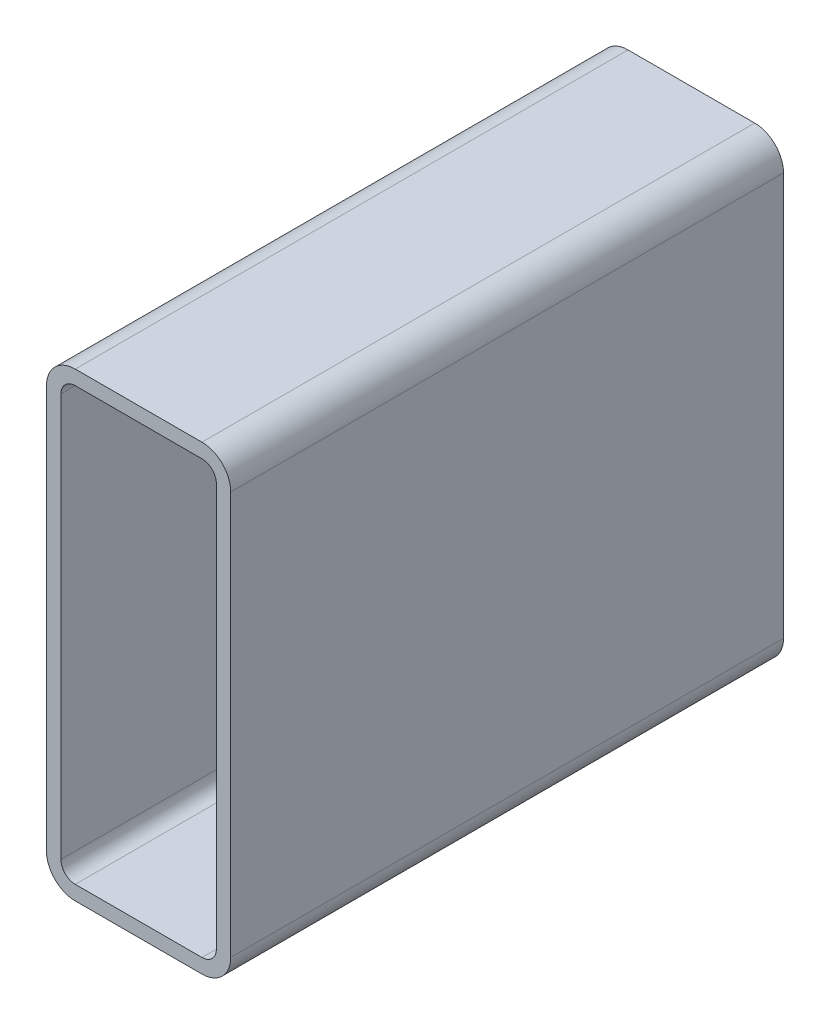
SolidWorks part; units mm, degrees
ref_plane "Front Plane" through (0, 0, 0) normal (0, 0, 1) x (1, 0, 0)
ref_plane "Top Plane" through (0, 0, 0) normal (0, 1, 0) x (1, 0, 0)
ref_plane "Right Plane" through (0, 0, 0) normal (1, 0, 0) x (0, 0, -1)
sketch "Sketch1" plane through (0, 0, 0) normal (0, 0, 1) x (1, 0, 0)
sketch_block_instance "HSS10x4x0.3125-2"
sketch_block "HSS10x4x0.3125"
extrude "Boss-Extrude1" add sketch "Sketch1" along normal blind 304.8
